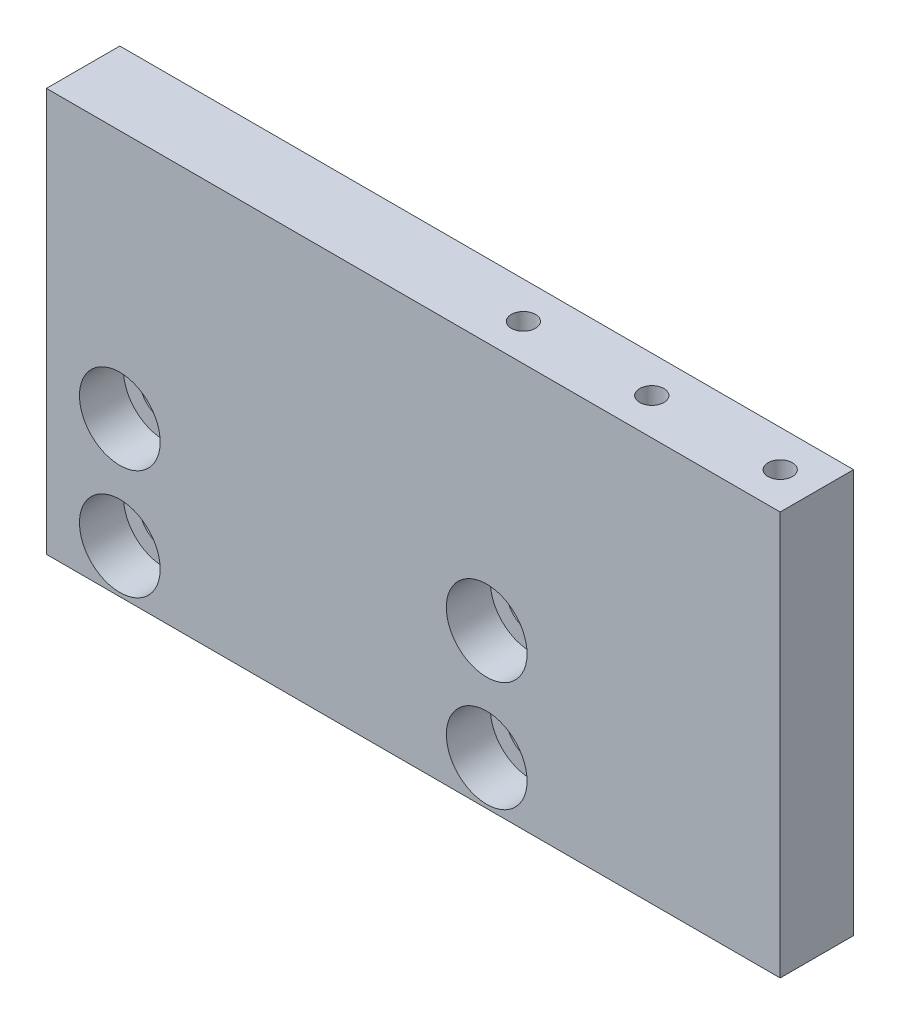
SolidWorks part; units mm, degrees
ref_plane "Face" through (0, 0, 0) normal (0, 0, 1) x (1, 0, 0)
ref_plane "Dessus" through (0, 0, 0) normal (0, 1, 0) x (1, 0, 0)
ref_plane "Droite" through (0, 0, 0) normal (1, 0, 0) x (0, 0, -1)
sketch "Esquisse1" plane through (0, 0, 0) normal (0, 0, 1) x (1, 0, 0)
  line L0 (-20, 27.5) -> (80, -27.5) construction
  line L1 (-20, 27.5) -> (80, 27.5)
  line L2 (-20, 27.5) -> (-20, -27.5)
  line L3 (-20, -27.5) -> (80, -27.5)
  line L4 (80, 27.5) -> (80, -27.5)
  line L5 (-20, 0) -> (0, 0) construction
  dimension "D1" = 100
  dimension "D2" = 55
  dimension "D3" = 20
extrude "Extrusion1" add sketch "Esquisse1" along normal blind 10
hole_wizard "Chambrage pour vis à tête hexagonale M61" positions "Esquisse3" profile "Esquisse2" counterbore size "M6" standard "ISO"
sketch "Esquisse3" plane through (0, 0, 10) normal (0, 0, 1) x (1, 0, 0)
  line L1 (40, -21.5) -> (-10, -21.5) construction
  line L2 (40, -21.5) -> (40, -6.5) construction
  line L3 (40, -6.5) -> (-10, -6.5) construction
  line L4 (-10, -21.5) -> (-10, -6.5) construction
  line L5 (-20, -27.5) -> (80, -27.5) construction
  line L6 (-20, 27.5) -> (-20, -27.5) construction
  point P0 (40, -21.5)
  point P1 (40, -6.5)
  point P2 (-10, -6.5)
  point P3 (-10, -21.5)
  dimension "D1" = 50
  dimension "D2" = 15
  dimension "D3" = 10
  dimension "D4" = 6
sketch "Esquisse2" plane through (40, -21.5, 10) normal (1, 0, 0) x (0, -1, 0)
  line L0 (0, 0) -> (0, 10)
  line L1 (0, 10) -> (3.3, 10)
  line L3 (3.3, 10) -> (3.3, 6)
  line L4 (3.3, 6) -> (5.5, 6)
  line L5 (5.5, 6) -> (5.5, 0)
  line L7 (5.5, 0) -> (0, 0)
  line L11 (0, -6.35) -> (0, 107.95) construction
  dimension "Diamètre du perçage jusqu'au prochain" = 6.6
  dimension "Profondeur du perçage jusqu'au prochain" = 10
  dimension "Diamètre du chambrage" = 11
  dimension "Profondeur du chambrage" = 6
hole_wizard "Trou taraudé M4x0.71" positions "Esquisse5" profile "Esquisse4" tap size "M4x0.7" standard "Ansi Métrique"
sketch "Esquisse5" plane through (0, 27.5, 0) normal (0, 1, 0) x (-1, 0, 0)
  line L0 (-40, 5) -> (-75, 5) construction
  line L1 (-80, 10) -> (-80, 0) construction
  line L2 (-57.5, 0) -> (-57.5, 10) construction
  line L3 (-80, 10) -> (20, 10) construction
  line L4 (-80, 0) -> (20, 0) construction
  point P0 (-75, 5)
  point P1 (-57.5, 5)
  point P2 (-40, 5)
  dimension "D1" = 35
  dimension "D2" = 5
sketch "Esquisse4" plane through (75, 27.5, 5) normal (1, 0, 0) x (0, 0, 1)
  line L0 (0, 0) -> (0, 10.9914)
  line L1 (0, 10.9914) -> (1.65, 10)
  line L2 (1.65, 10) -> (1.65, 0)
  line L5 (1.65, 0) -> (0, 0)
  line L10 (0, 10.9914) -> (-1.65, 10) construction
  line L11 (0, -6.35) -> (0, 107.95) construction
  dimension "Diamètre du trou pour taraudage" = 3.3
  dimension "Profondeur du trou pour taraudage" = 10
  dimension "Angle de pointe" = 118
